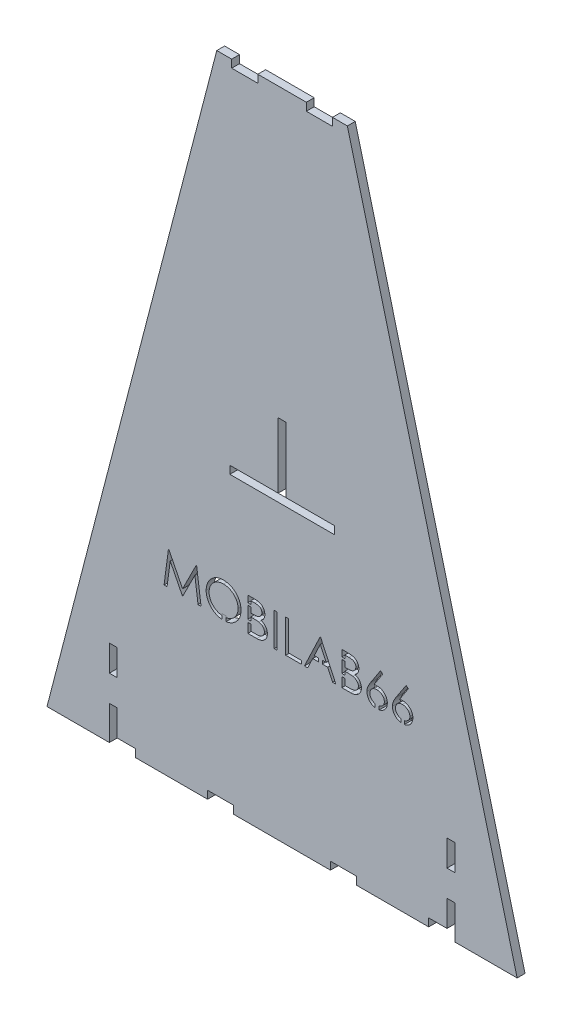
SolidWorks part; units mm, degrees
ref_plane "Plan de face" through (0, 0, 0) normal (0, 0, 1) x (1, 0, 0)
ref_plane "Plan de dessus" through (0, 0, 0) normal (0, 1, 0) x (1, 0, 0)
ref_plane "Plan de droite" through (0, 0, 0) normal (1, 0, 0) x (0, 0, -1)
sketch "Esquisse1" plane through (0, 0, 0) normal (0, 0, 1) x (1, 0, 0)
  line L0 (-90, -20) -> (-66.1305, -20)
  line L1 (-90, -20) -> (-25, 230)
  line L2 (-25, 230) -> (25, 230)
  line L3 (0, 0) -> (0, 132.8404) construction
  line L4 (-1.5, 120) -> (1.5, 120)
  line L5 (-1.5, 120) -> (-1.5, 95)
  line L6 (1.5, 95) -> (20, 95)
  line L7 (1.5, 120) -> (1.5, 95)
  line L8 (90, -20) -> (25, 230)
  line L9 (18.5112, -20) -> (18.5112, -17)
  line L10 (-20, 95) -> (-1.5, 95)
  line L11 (-20, 95) -> (-20, 92)
  line L12 (-20, 92) -> (20, 92)
  line L13 (20, 95) -> (20, 92)
  line L14 (-18.5112, -20) -> (18.5112, -20)
  line L15 (-66.1305, -20) -> (-66.1305, -17)
  line L16 (-66.1305, -17) -> (-56.1305, -17)
  line L17 (-56.1305, -20) -> (-56.1305, -17)
  line L18 (28.5112, -20) -> (56.1305, -20)
  line L19 (-28.5112, -20) -> (-28.5112, -17)
  line L20 (-28.5112, -17) -> (-18.5112, -17)
  line L21 (-18.5112, -20) -> (-18.5112, -17)
  line L22 (28.5112, -17) -> (18.5112, -17)
  line L23 (28.5112, -20) -> (28.5112, -17)
  line L24 (66.1305, -20) -> (90, -20)
  line L25 (56.1305, -20) -> (56.1305, -17)
  line L26 (66.1305, -17) -> (56.1305, -17)
  line L27 (66.1305, -20) -> (66.1305, -17)
  line L29 (-56.1305, -20) -> (-28.5112, -20)
  circle A0 centre (0, 94.0433) radius 26 construction
  circle A1 centre (0, 94.0433) radius 100 construction
  point P15 (0, 230)
  dimension "D7" = 52
  dimension "D8" = 200
  dimension "D1" = 3
  dimension "D2" = 25
  dimension "D3" = 140
  dimension "D4" = 180
  dimension "D5" = 250
  dimension "D6" = 50
  dimension "D9" = 3
  dimension "D10" = 40
  dimension "D11" = 10
  dimension "D12" = 3
extrude "Boss.-Extru.1" add sketch "Esquisse1" along normal blind 3
sketch "Esquisse2" plane through (0, 0, 3) normal (0, 0, 1) x (1, 0, 0)
  line L0 (0, 0) -> (0, 132.8404) construction
  line L1 (-63.1305, -17) -> (-66.1305, -17)
  line L2 (-63.1305, -17) -> (-63.1305, -7)
  line L3 (-63.1305, -7) -> (-66.1305, -7)
  line L4 (-66.1305, -17) -> (-66.1305, -7)
  line L5 (-66.1305, 3) -> (-63.1305, 3)
  line L6 (-66.1305, 3) -> (-66.1305, 13)
  line L7 (-66.1305, 13) -> (-63.1305, 13)
  line L8 (-63.1305, 3) -> (-63.1305, 13)
  line L9 (0, 0) -> (0, 132.8404) construction
  line L10 (63.1305, 3) -> (63.1305, 13)
  line L11 (66.1305, 13) -> (63.1305, 13)
  line L12 (66.1305, 3) -> (66.1305, 13)
  line L13 (66.1305, 3) -> (63.1305, 3)
  line L14 (66.1305, -17) -> (66.1305, -7)
  line L15 (63.1305, -7) -> (66.1305, -7)
  line L16 (63.1305, -17) -> (63.1305, -7)
  line L17 (63.1305, -17) -> (66.1305, -17)
  dimension "D1" = 3
  dimension "D2" = 10
  dimension "D3" = 10
  dimension "D4" = 3
  dimension "D5" = 10
extrude "Enlèv. mat.-Extru.1" cut sketch "Esquisse2" against normal through all
sketch "Esquisse3" plane through (0, 0, 3) normal (0, 0, 1) x (1, 0, 0)
  line L0 (-25, 230) -> (25, 230) construction
  line L1 (-19.29, 230) -> (-9.29, 230)
  line L2 (-19.29, 230) -> (-19.29, 227)
  line L3 (-19.29, 227) -> (-9.29, 227)
  line L4 (-9.29, 230) -> (-9.29, 227)
  line L5 (0, 230) -> (0, 174.1187) construction
  line L6 (9.29, 230) -> (9.29, 227)
  line L7 (19.29, 227) -> (9.29, 227)
  line L8 (19.29, 230) -> (19.29, 227)
  line L9 (19.29, 230) -> (9.29, 230)
  dimension "D1" = 3
  dimension "D2" = 10
extrude "Enlèv. mat.-Extru.2" cut sketch "Esquisse3" against normal blind 120
sketch "Esquisse4" plane through (0, 0, 3) normal (0, 0, 1) x (1, 0, 0)
  text T0 "MOBILAB66" font "Century Gothic" height in points 48
extrude "Enlèv. mat.-Extru.3" cut sketch "Esquisse4" against normal blind 3
sketch "Esquisse5" plane through (0, 0, 3) normal (0, 0, 1) x (1, 0, 0)
  line L0 (-13.1113, 42.6998) -> (-13.1113, 55.3998) construction
  line L1 (-13.1113, 52.8878) -> (-11.9716, 52.8878)
  line L2 (-13.1113, 52.8878) -> (-13.1113, 52.062)
  line L3 (-13.1113, 52.062) -> (-11.9716, 52.062)
  line L4 (-11.9716, 52.8878) -> (-11.9716, 52.062)
  line L5 (-11.9716, 54.0973) -> (-11.9716, 50.0268) construction
  line L6 (-11.9716, 48.7242) -> (-11.9716, 44.0024) construction
  line L7 (-11.9716, 46.3633) -> (-13.1113, 46.3633)
  line L8 (-11.9716, 46.3633) -> (-11.9716, 47.3929)
  line L9 (-11.9716, 47.3929) -> (-13.1113, 47.3929)
  line L10 (-13.1113, 46.3633) -> (-13.1113, 47.3929)
  line L11 (24.0117, 54.0973) -> (24.0117, 50.0268) construction
  line L12 (24.0117, 52.062) -> (22.872, 52.062)
  line L13 (24.0117, 52.062) -> (24.0117, 52.8878)
  line L14 (24.0117, 52.8878) -> (22.872, 52.8878)
  line L15 (22.872, 52.062) -> (22.872, 52.8878)
  line L16 (22.872, 42.6998) -> (22.872, 55.3998) construction
  line L17 (24.0117, 48.7242) -> (24.0117, 44.0024) construction
  line L18 (24.0117, 46.3633) -> (22.872, 46.3633)
  line L19 (24.0117, 46.3633) -> (24.0117, 47.3929)
  line L20 (24.0117, 47.3929) -> (22.872, 47.3929)
  line L21 (22.872, 46.3633) -> (22.872, 47.3929)
  line L22 (12.337, 48.0729) -> (16.8756, 48.0729) construction
  line L23 (13.9447, 48.0729) -> (15.3871, 48.0729)
  line L24 (13.9447, 48.0729) -> (13.9447, 46.7704)
  line L25 (13.9447, 46.7704) -> (15.3871, 46.7704)
  line L26 (15.3871, 48.0729) -> (15.3871, 46.7704)
  line L27 (17.476, 46.7704) -> (11.7188, 46.7704) construction
  line L29 (35.5561, 44.0024) -> (37.1962, 44.0024)
  line L30 (35.5561, 44.0024) -> (35.5561, 41.4914)
  line L31 (35.5561, 41.4914) -> (37.1962, 41.4914)
  line L32 (37.1962, 44.0024) -> (37.1962, 41.4914)
  line L33 (45.4531, 44.0024) -> (46.8104, 44.0024)
  line L34 (45.4531, 44.0024) -> (45.4531, 41.4914)
  line L35 (45.4531, 41.4914) -> (46.8104, 41.4914)
  line L36 (46.8104, 44.0024) -> (46.8104, 41.4914)
  line L37 (-23.0227, 44.3345) -> (-21.4216, 44.3345)
  line L38 (-23.0227, 44.3345) -> (-23.0227, 41.4914)
  line L39 (-23.0227, 41.4914) -> (-21.4216, 41.4914)
  line L40 (-21.4216, 44.3345) -> (-21.4216, 41.4914)
extrude "Boss.-Extru.2" add sketch "Esquisse5" against normal blind 3
